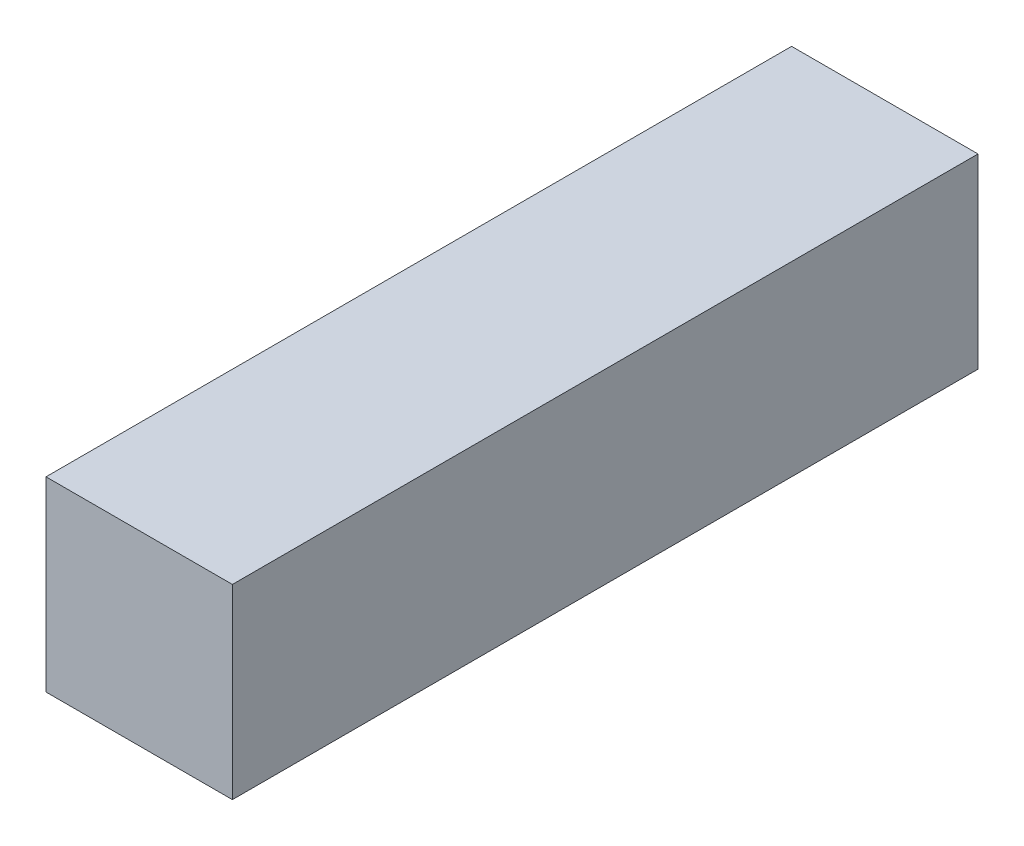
SolidWorks part; units mm, degrees
ref_plane "Face" through (0, 0, 0) normal (0, 0, 1) x (1, 0, 0)
ref_plane "Dessus" through (0, 0, 0) normal (0, 1, 0) x (1, 0, 0)
ref_plane "Droite" through (0, 0, 0) normal (1, 0, 0) x (0, 0, -1)
sketch "Esquisse1" plane through (0, 0, 0) normal (0, 0, 1) x (1, 0, 0)
  line L1 (0, 0) -> (25, 0)
  line L2 (0, 0) -> (0, 25)
  line L3 (0, 25) -> (25, 25)
  line L4 (25, 0) -> (25, 25)
  dimension "D1" = 25
  dimension "D2" = 25
extrude "Extrusion1" add sketch "Esquisse1" along normal blind 100
